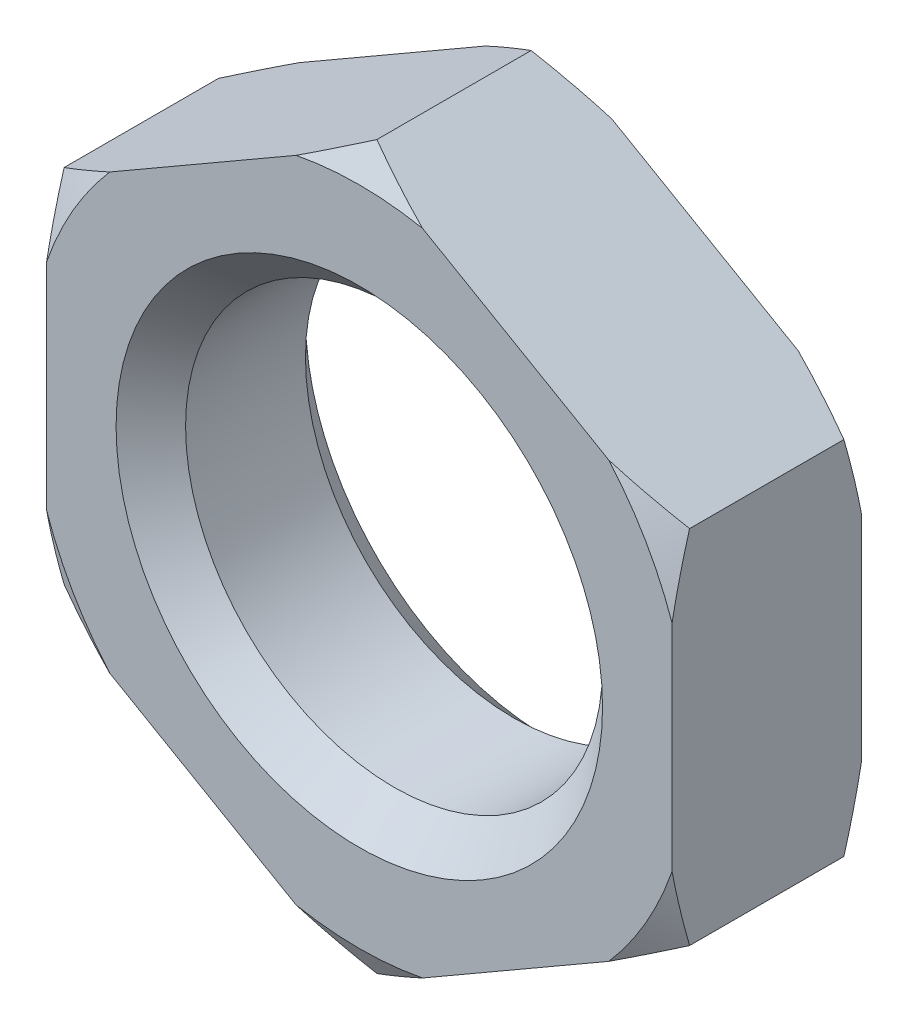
SolidWorks part; units mm, degrees
ref_plane "Front Plane" through (0, 0, 0) normal (0, 0, 1) x (1, 0, 0)
ref_plane "Top Plane" through (0, 0, 0) normal (0, 1, 0) x (1, 0, 0)
ref_plane "Right Plane" through (0, 0, 0) normal (1, 0, 0) x (0, 0, -1)
sketch "Sketch1" plane through (0, 0, 0) normal (0, 0, 1) x (1, 0, 0)
  line L1 (0, 20.7846) -> (-18, 10.3923)
  line L2 (-18, 10.3923) -> (-18, -10.3923)
  line L3 (-18, -10.3923) -> (0, -20.7846)
  line L4 (0, -20.7846) -> (18, -10.3923)
  line L5 (18, -10.3923) -> (18, 10.3923)
  line L6 (18, 10.3923) -> (0, 20.7846)
  circle A0 centre (0, 0) radius 18 construction
  circle A1 centre (0, 0) radius 12
  dimension "D2" = 24
  dimension "D1" = 36
extrude "Boss-Extrude1" add sketch "Sketch1" along normal mid plane 10.9
sketch "Sketch2" plane through (0, 0, 0) normal (1, 0, 0) x (0, 0, -1)
  line L0 (7.477, 0) -> (-8.5759, 0) construction
sketch "Sketch3" plane through (0, 0, 0) normal (1, 0, 0) x (0, 0, -1)
  line L0 (-5.45, 20.7846) -> (-5.45, 19.0346)
  line L1 (-5.45, 10.3923) -> (-5.45, 20.7846) construction
  line L2 (-5.45, 19.0346) -> (-4.4396, 20.7846)
  line L3 (-5.45, 20.7846) -> (5.45, 20.7846) construction
  line L4 (-4.4396, 20.7846) -> (-5.45, 20.7846)
  dimension "D1" = 1.75
  dimension "D2" = 30
revolve "Cut-Revolve1" cut sketch "Sketch3" angle 360 about L0
mirror "Mirror1" about plane through (0, 0, 0) normal (0, 0, 1) of "Cut-Revolve1"
chamfer "Chamfer1" distance 2 angle 45 2 edges at (12, 0, -5.45) (12, 0, 5.45)
